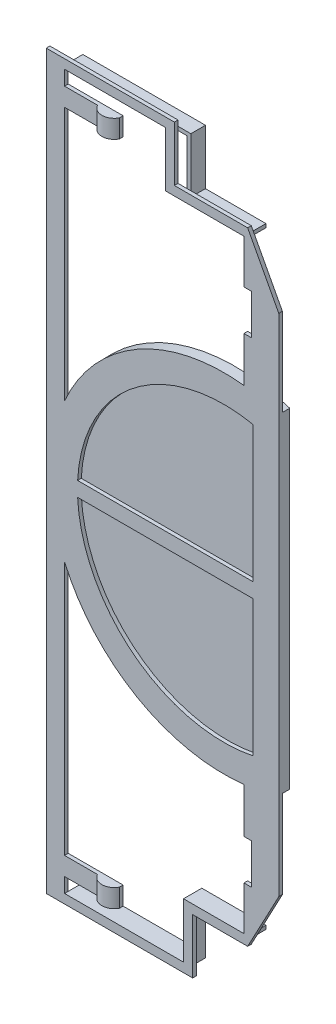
SolidWorks part; units mm, degrees
ref_plane "Face" through (0, 0, 0) normal (0, 0, 1) x (1, 0, 0)
ref_plane "Dessus" through (0, 0, 0) normal (0, 1, 0) x (1, 0, 0)
ref_plane "Droite" through (0, 0, 0) normal (1, 0, 0) x (0, 0, -1)
sketch "Esquisse1" plane through (0, 0, 0) normal (0, 0, 1) x (1, 0, 0)
  line L1 (56.7059, 85) -> (36.6853, 85)
  line L3 (36.6853, 85) -> (36.6853, 100)
  line L5 (1.6853, 100) -> (36.6853, 100)
  line L7 (56.7059, -85) -> (41.6853, -85)
  line L9 (41.6853, -85) -> (41.6853, -100)
  line L11 (1.6853, -100) -> (41.6853, -100)
  line L12 (1.6853, -100) -> (1.6853, 100)
  line L13 (40.376, 0) -> (-85.3305, 0) construction
  line L14 (-85.3305, 0) -> (120.7884, 0) construction
  line L15 (56.7059, 85) -> (65.2059, 69)
  line L16 (56.7059, -85) -> (65.2059, -69)
  line L17 (65.2059, 69) -> (65.2059, -69)
  line L18 (55.7059, 45) -> (58.2059, 45)
  line L20 (55.7059, -45) -> (58.2059, -45)
  line L21 (58.2059, 45) -> (58.2059, -45)
  line L23 (34.3254, 97.5) -> (6.6853, 97.5)
  line L24 (55.7059, 45) -> (55.7059, 82.5)
  line L26 (34.3254, 82.5) -> (34.3254, 97.5)
  line L29 (55.7059, 82.5) -> (34.3254, 82.5)
  line L32 (55.7059, -82.5) -> (55.7059, -45)
  line L35 (55.7059, -82.5) -> (39.1832, -82.5)
  line L38 (39.1832, -82.5) -> (39.1832, -97.5)
  line L39 (6.6853, 97.5) -> (6.6853, -97.5)
  line L41 (39.1832, -97.5) -> (6.6853, -97.5)
  point P16 (65.2059, 0)
  point P45 (58.2059, 0)
  dimension "D1" = 16
  dimension "D10" = 5
  dimension "D11" = 90
  dimension "D12" = 7
  dimension "D13" = 35
extrude "Plaque" add sketch "Esquisse1" along normal blind 1
sketch "Esquisse2" plane through (0, 0, 1) normal (0, 0, 1) x (1, 0, 0)
  line L0 (65.2059, -69) -> (65.2059, 69) construction
  line L1 (65.2059, -45.0694) -> (65.2059, 45.0694)
  line L2 (58.2059, -45) -> (58.2059, 45) construction
  line L3 (58.2059, -39.1918) -> (58.2059, -2)
  line L4 (0, 0) -> (65.2059, 0) construction
  line L5 (10.2559, 2) -> (58.2059, 2)
  line L6 (10.2559, -2) -> (58.2059, -2)
  line L7 (58.2059, 2) -> (58.2059, 39.1918)
  arc A0 (65.2059, 45.0694) -> (65.2059, -45.0694) centre (50.2059, 0) ccw
  arc A1 (58.2059, 39.1918) -> (10.2559, 2) centre (50.2059, 0) ccw
  arc A2 (10.2559, -2) -> (58.2059, -39.1918) centre (50.2059, 0) ccw
  dimension "D1" = 95
  dimension "D3" = 80
  dimension "D2" = 15
  dimension "D4" = 4
extrude "Cercle filtre" add sketch "Esquisse2" against normal blind 3
sketch "Esquisse7" plane through (0, 0, 0) normal (0, 0, -1) x (-1, 0, 0)
  line L1 (-39.1832, 97.5) -> (-6.6853, 97.5)
  line L3 (-39.1832, 82.5) -> (-39.1832, 97.5)
  line L5 (-55.7059, 82.5) -> (-39.1832, 82.5)
  line L7 (-55.7059, 82.5) -> (-56.7059, 82.5)
extrude "Mur de centrage" add sketch "Esquisse7" along normal blind 4 thin
mirror "Symétrie1" about plane through (0, 0, 0) normal (0, 1, 0) of "Mur de centrage"
sketch "Esquisse8" plane through (0, 0, 0) normal (0, 0, -1) x (-1, 0, 0)
  line L0 (-58.2059, -2) -> (-10.2559, -2) construction
  line L1 (-58.2059, -2) -> (-10.2559, -2)
  line L2 (-58.2059, -39.1918) -> (-58.2059, -2) construction
  line L3 (-58.2059, -39.1918) -> (-58.2059, -2)
  line L4 (-10.2559, 2) -> (-58.2059, 2) construction
  line L5 (-10.2559, 2) -> (-58.2059, 2)
  line L6 (-58.2059, 2) -> (-58.2059, 39.1918) construction
  line L7 (-58.2059, 2) -> (-58.2059, 39.1918)
  arc A0 (-58.2059, -39.1918) -> (-10.2559, -2) centre (-50.2059, 0) ccw construction
  arc A1 (-58.2059, -39.1918) -> (-10.2559, -2) centre (-50.2059, 0) ccw
  arc A2 (-10.2559, 2) -> (-58.2059, 39.1918) centre (-50.2059, 0) ccw construction
  arc A3 (-10.2559, 2) -> (-58.2059, 39.1918) centre (-50.2059, 0) ccw
extrude "Filtre" add sketch "Esquisse8" along normal blind 1
sketch "Esquisse10" plane through (0, 0, 1) normal (0, 0, 1) x (1, 0, 0)
  line L0 (0, 0) -> (65.2059, 0) construction
  line L1 (65.2059, -69) -> (65.2059, 69) construction
  line L2 (55.7059, 47.1805) -> (55.7059, 82.5) construction
  line L3 (55.7059, 70.5) -> (57.7059, 70.5)
  line L4 (55.7059, 70.5) -> (55.7059, 59.5)
  line L5 (55.7059, 59.5) -> (57.7059, 59.5)
  line L6 (57.7059, 70.5) -> (57.7059, 59.5)
  line L7 (55.7059, -70.5) -> (55.7059, -59.5)
  line L8 (55.7059, -70.5) -> (57.7059, -70.5)
  line L9 (57.7059, -70.5) -> (57.7059, -59.5)
  line L10 (55.7059, -59.5) -> (57.7059, -59.5)
  line L11 (57.7059, 65) -> (55.7059, 65) construction
  line L12 (57.7059, -65) -> (55.7059, -65) construction
  dimension "D1" = 11
  dimension "D2" = 130
  dimension "D3" = 2
extrude "Clips arrière" cut sketch "Esquisse10" against normal blind 1.5
ref_plane "Plan1" through (21, 0, 0) normal (1, 0, 0) x (0, 0, -1)
ref_plane "Plan2" through (0, 91, 0) normal (0, 1, 0) x (-1, 0, 0)
sketch "Esquisse13" plane through (0, 91, 0) normal (0, 1, 0) x (-1, 0, 0)
  line L0 (-6.6853, 1) -> (-15.6853, 1)
  line L1 (-36.6853, 1) -> (-1.6853, 1) construction
  line L2 (-6.6853, 0) -> (-21.6853, 0)
  line L3 (-36.6853, 0) -> (-1.6853, 0) construction
  line L4 (-21.6853, 0) -> (-21.6853, 1)
  line L5 (-21.6853, 1) -> (-15.6853, 1) construction
  line L6 (-18.6853, 1) -> (-18.6853, -0.6) construction
  line L7 (-6.6853, 1) -> (-6.6853, 0)
  line L8 (-30.2617, 2.8) -> (-26.1465, 2.8) construction
  arc A0 (-21.6853, 1) -> (-15.6853, 1) centre (-18.6853, -0.6) cw
  dimension "D1" = 12
  dimension "D2" = 6
  dimension "D3" = 1.8
extrude "Clip dessus" add sketch "Esquisse13" along normal mid plane 5
mirror "Symétrie3" about plane through (0, 0, 0) normal (0, 1, 0) of "Clip dessus"
